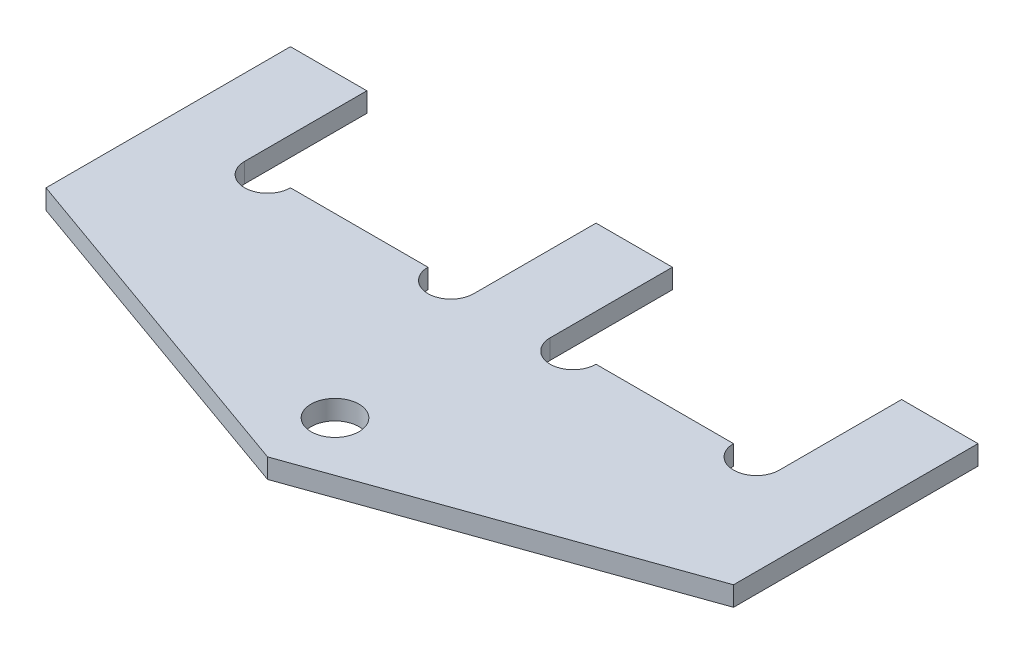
SolidWorks part; units mm, degrees
ref_plane "Front Plane" through (0, 0, 0) normal (0, 0, 1) x (1, 0, 0)
ref_plane "Top Plane" through (0, 0, 0) normal (0, 1, 0) x (1, 0, 0)
ref_plane "Right Plane" through (0, 0, 0) normal (1, 0, 0) x (0, 0, -1)
sketch "Sketch1" plane through (0, 0, 0) normal (0, 1, 0) x (1, 0, 0)
  line L0 (0, 0) -> (0, 41.7514) construction
  line L1 (0, -7.0104) -> (35.7188, 5.6896)
  line L2 (35.7188, 5.6896) -> (35.7188, 31.0896)
  line L3 (0, -7.0104) -> (-35.7188, 5.6896)
  line L4 (-35.7188, 5.6896) -> (-35.7188, 31.0896)
  line L5 (-35.7188, 31.0896) -> (-27.7812, 31.0896)
  line L6 (-27.7812, 31.0896) -> (-27.7812, 18.3896)
  line L7 (-3.9688, 31.0896) -> (-3.9687, 18.3896)
  line L8 (3.9688, 31.0896) -> (3.9687, 18.3896)
  line L9 (27.7812, 31.0896) -> (27.7812, 18.3896)
  line L10 (35.7188, 31.0896) -> (27.7812, 31.0896)
  line L11 (-3.9688, 31.0896) -> (3.9688, 31.0896)
  line L12 (-23.0187, 18.3896) -> (-8.7312, 18.3896)
  line L13 (23.0187, 18.3896) -> (8.7312, 18.3896)
  circle A0 centre (0, 0) radius 2.4892
  arc A1 (-27.7812, 18.3896) -> (-23.0187, 18.3896) centre (-25.4, 18.3896) ccw
  arc A2 (-3.9687, 18.3896) -> (-8.7312, 18.3896) centre (-6.35, 18.3896) cw
  arc A3 (3.9687, 18.3896) -> (8.7312, 18.3896) centre (6.35, 18.3896) ccw
  arc A4 (27.7812, 18.3896) -> (23.0187, 18.3896) centre (25.4, 18.3896) cw
  point P17 (-31.75, 31.0896)
  dimension "D1" = 4.9784
  dimension "D6" = 7.0104
  dimension "D7" = 2.3813
  dimension "D2" = 31.75
  dimension "D3" = 7.9375
  dimension "D4" = 25.4
  dimension "D5" = 38.1
  dimension "D8" = 12.7
base flange "Base-Flange1" sketch "Sketch1" thickness 2.032 reverse thickness direction no parameters "D1"=1.524
sketch "Bend-Lines1" plane through (0, 0, 0) normal (0, 1, 0) x (1, 0, 0)
sketch "Bounding-Box1" plane through (0, 0, 0) normal (0, 1, 0) x (1, 0, 0)
sheet metal parameters "Sheet-Metal1" thickness 2.032 parameters "D1"=1.524
flat pattern "Flat-Pattern1"
sketch "Bend-Lines2" plane through (0, 0, 0) normal (0, 1, 0) x (1, 0, 0)
sketch "Bounding-Box2" [suppressed] plane through (0, 0, 0) normal (0, 1, 0) x (1, 0, 0)
